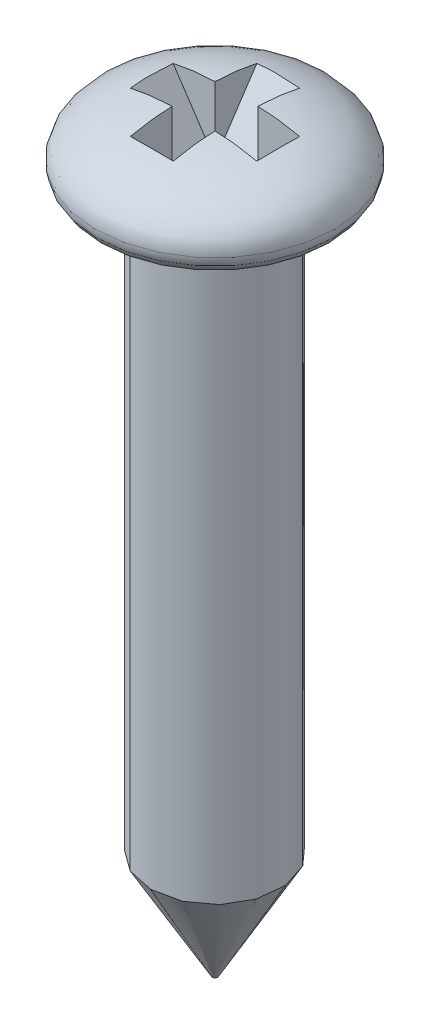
SolidWorks part; units mm, degrees
ref_plane "Plan de face" through (0, 0, 0) normal (0, 0, 1) x (1, 0, 0)
ref_plane "Plan de dessus" through (0, 0, 0) normal (0, 1, 0) x (1, 0, 0)
ref_plane "Plan de droite" through (0, 0, 0) normal (1, 0, 0) x (0, 0, -1)
ref_plane "Plan3" through (0, 6.4, 0) normal (0, 1, 0) x (-1, 0, 0)
sketch "Esquisse1" plane through (0, 6.4, 0) normal (0, 1, 0) x (-1, 0, 0)
  circle A0 centre (0, 0) radius 1.5
extrude "Extrusion1" add sketch "Esquisse1" against normal blind 16
sketch "Esquisse2" plane through (0, 0, 0) normal (0, 0, 1) x (1, 0, 0)
  line L0 (-3.5764, 6.4) -> (3.9855, 6.4) construction
  line L1 (0, 8.9067) -> (0, 4.7448) construction
  line L2 (-2.6992, 8) -> (4.0303, 8) construction
  line L3 (-2.8, 8.6386) -> (-2.8, 5.3938) construction
  line L4 (0, 6.4) -> (-2.3, 6.4)
  line L5 (0, 8) -> (0, 6.4)
  arc A0 (-2.3, 6.4) -> (-2.8, 6.9001) centre (-2.3, 6.9) cw
  spline S0 degree 3 poles (-2.8, 6.9001) (-2.802, 7.3106) (-1.7042, 7.9956) (-0.6729, 7.9983) (0, 8) knots 0 0 0 0 0.347597 1 1 1 1
  point P15 (-2.8, 6.4)
  point P18 (-2.8, 8)
  point P21 (0, 6.4)
  dimension "D1" = 0.5
revolve "Révolution1" add sketch "Esquisse2" angle 360 about L1
sketch "Esquisse3" plane through (0, 0, 0) normal (0, 0, 1) x (1, 0, 0)
  line L0 (0, 9.9885) -> (0, 5.1977) construction
  line L1 (-3.3122, 6.4) -> (4.0377, 6.4) construction
  line L2 (-3.6691, 0) -> (6.2564, 0) construction
  line L3 (-1.5, 8.9361) -> (-1.5, 5.7428) construction
  line L4 (-0.5, 7.218) -> (-0.5, 5.7428) construction
  line L5 (0, 8.589) -> (-1.5, 8.3981)
  line L6 (-2.5295, 7.9) -> (1.4809, 7.9) construction
  line L7 (-1.5, 8.3981) -> (-1.5, 7.9)
  line L8 (-1.5, 7.9) -> (-0.5, 6.4)
  line L9 (-0.5, 6.4) -> (0.5, 6.4)
  line L10 (1.5, 7.9) -> (0.5, 6.4)
  line L11 (1.5, 8.3981) -> (1.5, 7.9)
  line L12 (0, 8.589) -> (1.5, 8.3981)
  point P19 (0, 6.4)
extrude "Enlèv. mat.-Extru.1" cut sketch "Esquisse3" against normal mid plane 1
pattern_circular "Répétition circulaire1" count 2 every 90 about axis through (0, 0, 0) along (0, 1, 0) of "Enlèv. mat.-Extru.1"
chamfer "Chanfrein1" distance 1.44 distance2 2.5 1 edges at (0, -9.6, 1.5)
